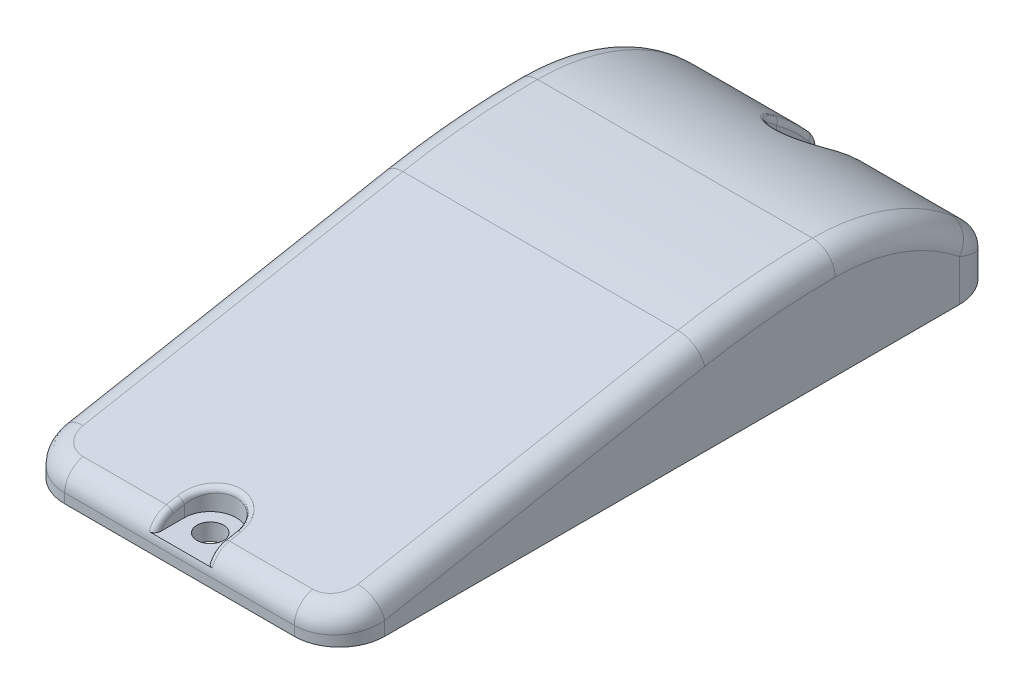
SolidWorks part; units mm, degrees
ref_plane "Front Plane" through (0, 0, 0) normal (0, 0, 1) x (1, 0, 0)
ref_plane "Top Plane" through (0, 0, 0) normal (0, 1, 0) x (1, 0, 0)
ref_plane "Right Plane" through (0, 0, 0) normal (1, 0, 0) x (0, 0, -1)
sketch "Sketch1" plane through (0, 0, 0) normal (1, 0, 0) x (0, 0, -1)
  line L0 (0, 0) -> (149.5044, 0)
  line L1 (0, 0) -> (0, 6.35)
  line L2 (0, 6.35) -> (149.5044, 6.35) construction
  line L3 (149.5044, 6.35) -> (149.5044, 0)
  line L4 (111.4044, 0) -> (111.4044, 24.384) construction
  line L5 (0, 6.35) -> (81.1349, 21.5695)
  line L6 (111.4044, 24.384) -> (-41.8751, 24.384) construction
  arc A0 (149.5044, 6.35) -> (111.4044, 24.384) centre (111.4044, -24.8795) ccw
  arc A1 (111.4044, 24.384) -> (81.1349, 21.5695) centre (111.4044, -139.7965) ccw
  dimension "D1" = 149.5044
  dimension "D2" = 6.35
  dimension "D3" = 24.384
  dimension "D4" = 38.1
  dimension "D5" = 82.55
extrude "Boss-Extrude1" add sketch "Sketch1" along normal blind 71.9582
fillet "Fillet2" radius 10.16 4 edges at (0, 3.175, -149.5044) (71.9582, 3.175, -149.5044) (0, 3.175, 0) (71.9582, 3.175, 0)
fillet "Fillet1" radius 5.08 12 edges at (71.9582, 22.1615, -126.0344) (0, 22.1615, -126.0344) (35.9791, 6.35, -149.5044) (0, 14.9127, -45.6474) (0, 23.6789, -96.2044) (71.9582, 23.6789, -96.2044) (35.9791, 6.35, 0) (71.9582, 14.9127, -45.6474) (2.9758, 6.9082, -2.9758) (68.9824, 6.9082, -2.9758) (68.7496, 9.4322, -146.7541) (5.3658, 7.7617, -148.3021)
shell "Shell1" thickness 2.54
sketch "Sketch3" plane through (0, 0, 0) normal (0, -1, 0) x (1, 0, 0)
  line L0 (44.2976, -2.54) -> (44.2976, -6.9215)
  line L1 (61.7982, -2.54) -> (10.16, -2.54) construction
  line L2 (44.2976, -6.9215) -> (27.6606, -6.9215) construction
  line L3 (27.6606, -6.9215) -> (27.6606, -2.54)
  line L4 (27.6606, -2.54) -> (44.2976, -2.54)
  line L5 (35.9791, -146.9644) -> (35.9791, -2.54) construction
  line L6 (61.7982, -146.9644) -> (10.16, -146.9644) construction
  line L8 (61.7982, 0) -> (10.16, 0) construction
  line L9 (44.2976, -146.9644) -> (44.2976, -140.0429)
  line L10 (44.2976, -140.0429) -> (27.6606, -140.0429) construction
  line L11 (27.6606, -140.0429) -> (27.6606, -146.9644)
  line L12 (27.6606, -146.9644) -> (44.2976, -146.9644)
  arc A0 (44.2976, -6.9215) -> (27.6606, -6.9215) centre (35.9791, -6.9215) cw
  arc A1 (44.2976, -140.0429) -> (27.6606, -140.0429) centre (35.9791, -140.0429) ccw
  point P10 (35.9791, -2.54)
  point P16 (35.9791, -146.9644)
  dimension "D2" = 15.24
  dimension "D3" = 15.24
  dimension "D1" = 16.637
extrude "Boss-Extrude4" add sketch "Sketch3" against normal up to next
sketch "Sketch4" plane through (0, 0, 0) normal (0, -1, 0) x (1, 0, 0)
  circle A0 centre (35.9791, -6.9215) radius 2.9845
  circle A1 centre (35.9791, -140.0429) radius 2.9845
  arc A2 (44.2976, -140.0429) -> (27.6606, -140.0429) centre (35.9791, -140.0429) ccw construction
  arc A3 (27.6606, -6.9215) -> (44.2976, -6.9215) centre (35.9791, -6.9215) ccw construction
  dimension "D1" = 5.969
extrude "Cut-Extrude1" cut sketch "Sketch4" against normal through all
ref_plane "Plane1" through (0, 24.384, 0) normal (0, 1, 0) x (1, 0, 0)
sketch "Sketch5" plane through (0, 24.384, 0) normal (0, 1, 0) x (1, 0, 0)
  line L0 (30.1371, 0) -> (41.8211, 0)
  line L1 (41.8211, 0) -> (41.8211, 6.9215)
  line L2 (41.8211, 6.9215) -> (30.1371, 6.9215) construction
  line L3 (30.1371, 6.9215) -> (30.1371, 0)
  line L4 (61.7982, 0) -> (10.16, 0) construction
  line L5 (30.1371, 149.5044) -> (41.8211, 149.5044)
  line L6 (41.8211, 149.5044) -> (41.8211, 140.0429)
  line L7 (41.8211, 140.0429) -> (30.1371, 140.0429) construction
  line L8 (30.1371, 140.0429) -> (30.1371, 149.5044)
  line L9 (10.16, 149.5044) -> (61.7982, 149.5044) construction
  arc A0 (30.1371, 6.9215) -> (41.8211, 6.9215) centre (35.9791, 6.9215) cw
  arc A1 (37.0697, 4.1434) -> (34.8885, 4.1434) centre (35.9791, 6.9215) ccw construction
  arc A2 (30.1371, 140.0429) -> (41.8211, 140.0429) centre (35.9791, 140.0429) ccw
  circle A3 centre (35.9791, 140.0429) radius 2.9845 construction
  dimension "D1" = 11.684
extrude "Cut-Extrude2" cut sketch "Sketch5" against normal offset from surface (20.574 mm away) 3.81
fillet "Fillet3" radius 1.27 12 edges at (30.1371, 5.9867, -1.7685) (30.1371, 7.3878, -5.5325) (41.8211, 5.9867, -1.7685) (41.8211, 7.3878, -5.5325) (41.8211, 4.144, -149.5044) (41.8211, 6.2836, -149.1727) (41.8211, 11.7578, -144.3376) (30.1371, 4.144, -149.5044) (30.1371, 6.2836, -149.1727) (30.1371, 11.7578, -144.3376) (35.9791, 8.7442, -12.7635) (36.3461, 10.3168, -145.8734)
